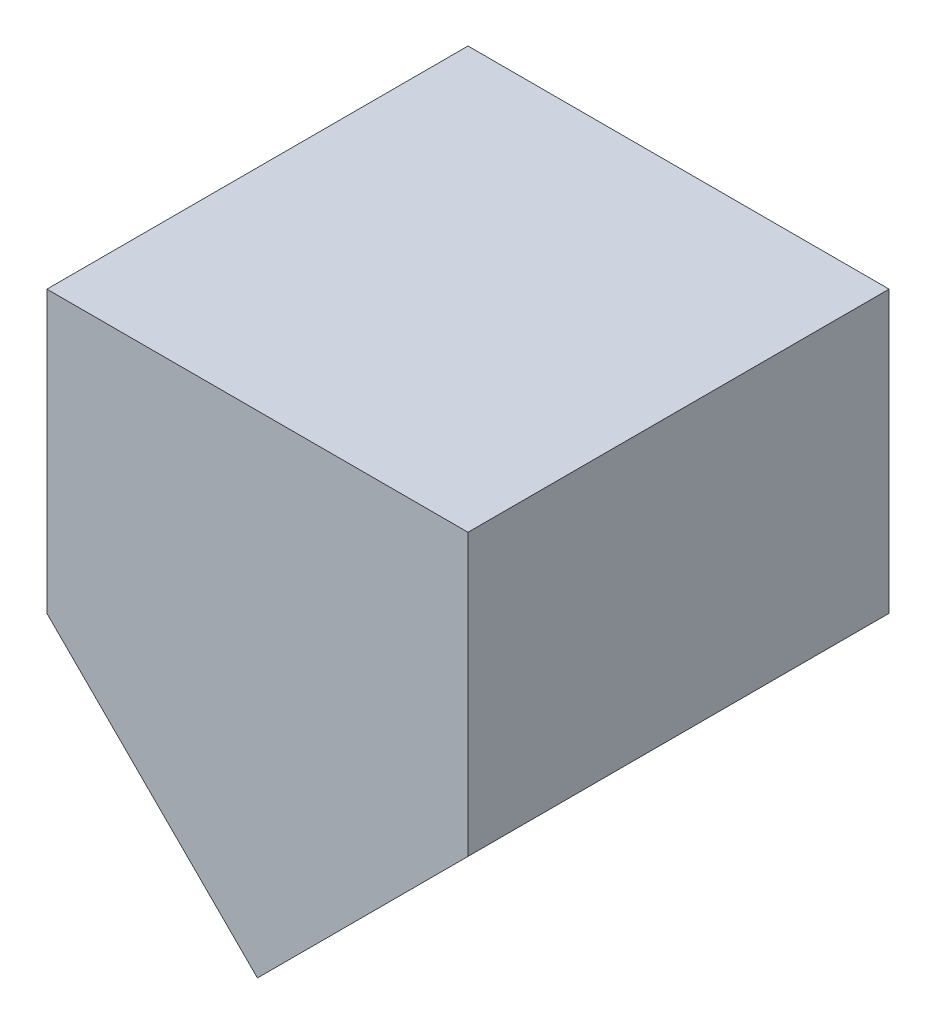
SolidWorks part; units mm, degrees
ref_plane "Front Plane" through (0, 0, 0) normal (0, 0, 1) x (1, 0, 0)
ref_plane "Top Plane" through (0, 0, 0) normal (0, 1, 0) x (1, 0, 0)
ref_plane "Right Plane" through (0, 0, 0) normal (1, 0, 0) x (0, 0, -1)
sketch "Sketch1" plane through (0, 0, 0) normal (0, 0, 1) x (1, 0, 0)
  line L0 (0, 0) -> (0, 35) construction
  line L1 (0, 0) -> (-15, 15)
  line L2 (0, 0) -> (15, 15)
  line L3 (15, 15) -> (15, 35)
  line L4 (-15, 15) -> (-15, 35)
  line L10 (-15, 35) -> (15, 35)
  dimension "D1" = 90
  dimension "D2" = 30
  dimension "D3" = 20
extrude "Extrude1" add sketch "Sketch1" along normal mid plane 30
